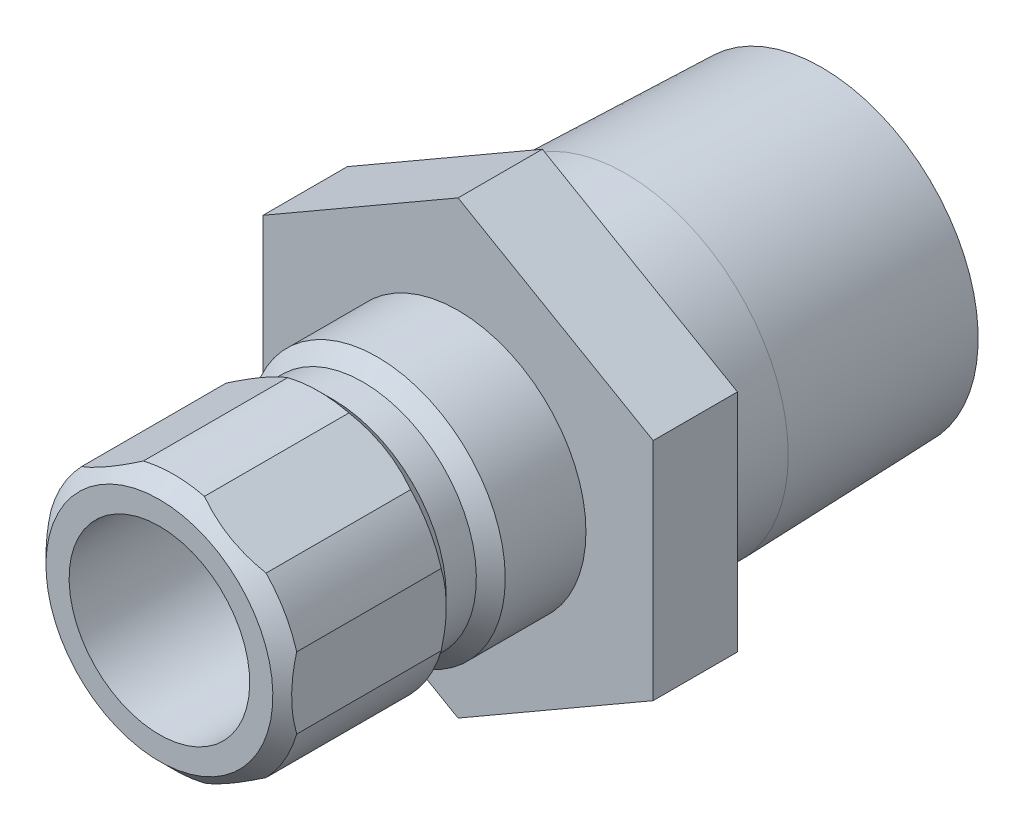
SolidWorks part; units mm, degrees
ref_plane "Front Plane" through (0, 0, 0) normal (0, 0, 1) x (1, 0, 0)
ref_plane "Top Plane" through (0, 0, 0) normal (0, 1, 0) x (1, 0, 0)
ref_plane "Right Plane" through (0, 0, 0) normal (1, 0, 0) x (0, 0, -1)
sketch "Sketch1" plane through (0, 0, 0) normal (1, 0, 0) x (0, 0, -1)
  line L0 (0, 0) -> (-18.923, 0) construction
  line L1 (-15.748, 4.7625) -> (-15.748, 5.9817)
  line L2 (-6.604, 5.9817) -> (-6.604, 0) construction
  line L3 (-14.986, 6.7437) -> (-7.366, 6.7437)
  line L4 (0, 8.5725) -> (0, 0) construction
  line L5 (-6.604, 5.9817) -> (-5.0165, 5.9817)
  line L6 (-4.2545, 6.7437) -> (0, 6.7437)
  line L7 (0, 6.7437) -> (0, 8.5725)
  line L8 (-6.604, 5.9817) -> (-7.366, 6.7437)
  line L9 (-5.0165, 5.9817) -> (-4.2545, 6.7437)
  line L10 (-15.748, 5.9817) -> (-14.986, 6.7437)
  line L11 (-15.748, 4.7625) -> (0.127, 4.7625)
  line L12 (0, 8.5725) -> (8.8392, 8.5725)
  line L13 (8.8392, 8.5725) -> (19.177, 8.2494)
  line L14 (19.177, 8.2494) -> (19.177, 6.2611)
  line L15 (0, 0) -> (4.445, 0) construction
  line L17 (0.9238, 6.2611) -> (19.177, 6.2611)
  line L18 (0.127, 4.7625) -> (0.9238, 6.2611)
  dimension "D1" = 15.748
  dimension "D2" = 1.5875
  dimension "D3" = 0.762
  dimension "D4" = 45
  dimension "D5" = 9.144
  dimension "D6" = 45
  dimension "D7" = 1.79
  dimension "D8" = 10.3378
  dimension "D9" = 34.925
  dimension "D10" = 3.175
  dimension "D11" = 9.525
  dimension "D12" = 17.145
  dimension "D13" = 4.445
  dimension "D14" = 13.4874
  dimension "D15" = 12.5222
  dimension "D16" = 15.875
  dimension "D17" = 118
revolve "Revolve1" add sketch "Sketch1" angle 360 about L0
sketch "Sketch2" plane through (0, 0, 0) normal (0, 0, 1) x (1, 0, 0)
  line L1 (-10.287, 5.9392) -> (-10.287, -5.9392)
  line L2 (-10.287, -5.9392) -> (0, -11.8784)
  line L3 (0, -11.8784) -> (10.287, -5.9392)
  line L4 (10.287, -5.9392) -> (10.287, 5.9392)
  line L5 (10.287, 5.9392) -> (0, 11.8784)
  line L6 (0, 11.8784) -> (-10.287, 5.9392)
  circle A0 centre (0, 0) radius 10.287 construction
  circle A1 centre (0, 0) radius 4.7625 construction
  circle A2 centre (0, 0) radius 4.7625
  dimension "D1" = 20.574
extrude "Boss-Extrude1" add sketch "Sketch2" against normal up to vertex (4.445 mm away)
sketch "Sketch3" plane through (0, 0, 0) normal (0, 0, 1) x (1, 0, 0)
  line L1 (-6.477, 3.7395) -> (-6.477, -3.7395)
  line L2 (-6.477, -3.7395) -> (0, -7.479)
  line L3 (0, -7.479) -> (6.477, -3.7395)
  line L4 (6.477, -3.7395) -> (6.477, 3.7395)
  line L5 (6.477, 3.7395) -> (0, 7.479)
  line L6 (0, 7.479) -> (-6.477, 3.7395)
  circle A0 centre (0, 0) radius 6.477 construction
  dimension "D1" = 12.954
extrude "Cut-Extrude1" cut sketch "Sketch3" along normal through all from vertex at 6.604 flip side to cut
